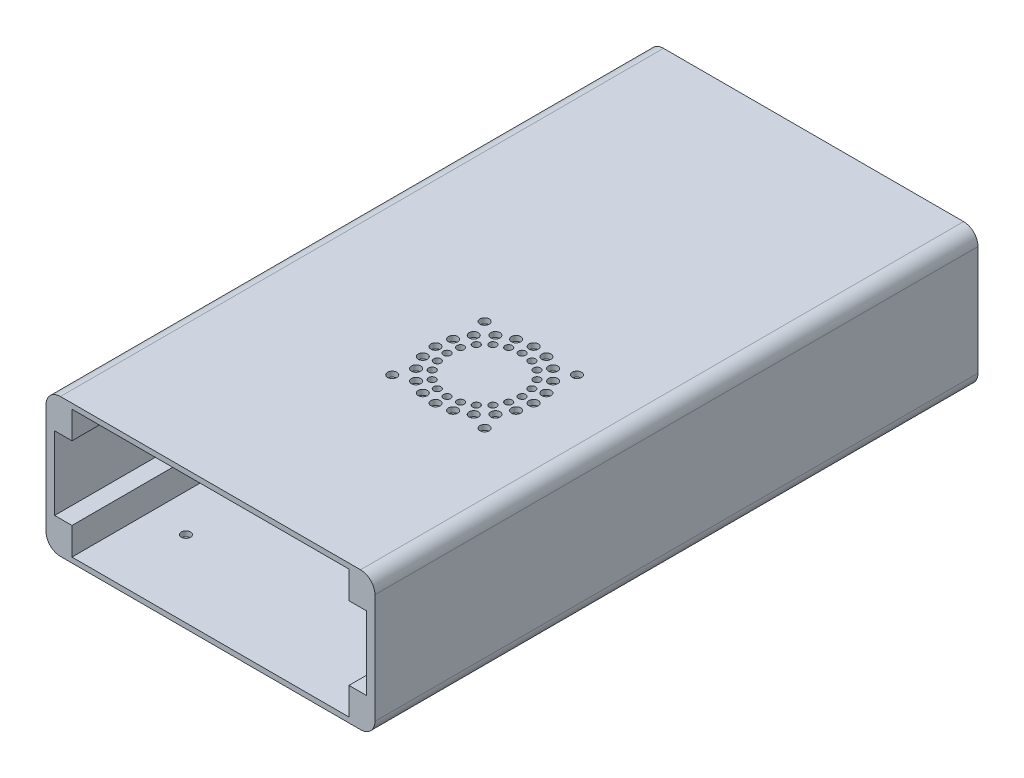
SolidWorks part; units mm, degrees
ref_plane "Front Plane" through (0, 0, 0) normal (0, 0, 1) x (1, 0, 0)
ref_plane "Top Plane" through (0, 0, 0) normal (0, 1, 0) x (1, 0, 0)
ref_plane "Right Plane" through (0, 0, 0) normal (1, 0, 0) x (0, 0, -1)
sketch "Sketch1" plane through (0, 0, 0) normal (0, 0, 1) x (1, 0, 0)
  line L0 (-110.5, 1) -> (-6.5, 1)
  line L1 (-1.5, 6) -> (-1.5, 44)
  line L2 (-6.5, 49) -> (-110.5, 49)
  line L3 (-115.5, 44) -> (-115.5, 6)
  line L8 (-10.5, 2.8) -> (-10.5, 12.3)
  line L9 (-106.5, 2.8) -> (-106.5, 12.3)
  line L10 (-106.5, 2.8) -> (-10.5, 2.8)
  line L11 (-10.5, 12.3) -> (-4.5, 12.3)
  line L12 (-106.5, 47.2) -> (-10.5, 47.2)
  line L13 (-10.5, 47.2) -> (-10.5, 37.7)
  line L14 (-106.5, 47.2) -> (-106.5, 37.7)
  line L15 (-106.5, 12.3) -> (-112.5, 12.3)
  line L16 (-112.5, 12.3) -> (-112.5, 37.7)
  line L17 (-112.5, 37.7) -> (-106.5, 37.7)
  line L18 (-4.5, 12.3) -> (-4.5, 37.7)
  line L19 (-4.5, 37.7) -> (-10.5, 37.7)
  arc A0 (-110.5, 1) -> (-115.5, 6) centre (-110.5, 6) cw
  arc A1 (-6.5, 1) -> (-1.5, 6) centre (-6.5, 6) ccw
  arc A2 (-1.5, 44) -> (-6.5, 49) centre (-6.5, 44) ccw
  arc A3 (-110.5, 49) -> (-115.5, 44) centre (-110.5, 44) ccw
  point P14 (-115.5, 1)
  point P17 (-1.5, 1)
  point P20 (-1.5, 49)
  dimension "D7" = 5
  dimension "D1" = 114
  dimension "D4" = 48
  dimension "D8" = 9
  dimension "D9" = 96
  dimension "D10" = 9
  dimension "D11" = 1.8
  dimension "D12" = 3
  dimension "D13" = 1.8
  dimension "D14" = 3
extrude "Boss-Extrude1" add sketch "Sketch1" against normal blind 209
sketch "Sketch2" plane through (0, 49, 0) normal (0, 1, 0) x (1, 0, 0)
  line L0 (-6.5, 0) -> (-110.5, 0) construction
  line L1 (-63.5, 100) -> (-23.5, 100) construction
  line L2 (-63.5, 100) -> (-63.5, 60) construction
  line L3 (-63.5, 60) -> (-23.5, 60) construction
  line L4 (-23.5, 100) -> (-23.5, 60) construction
  line L5 (-63.5, 100) -> (-23.5, 60) construction
  line L6 (-63.5, 60) -> (-23.5, 100) construction
  line L7 (-59.5, 96) -> (-27.5, 96) construction
  line L8 (-59.5, 96) -> (-59.5, 64) construction
  line L9 (-59.5, 64) -> (-27.5, 64) construction
  line L10 (-27.5, 96) -> (-27.5, 64) construction
  line L11 (-59.5, 96) -> (-27.5, 64) construction
  line L12 (-59.5, 64) -> (-27.5, 96) construction
  line L13 (-1.5, 209) -> (-1.5, 0) construction
  line L14 (-43.5, 80) -> (-75.4483, 80) construction
  circle A0 centre (-59.5, 96) radius 1.6
  circle A1 centre (-27.5, 96) radius 1.6
  circle A2 centre (-27.5, 64) radius 1.6
  circle A3 centre (-59.5, 64) radius 1.6
  circle A4 centre (-43.5, 80) radius 11 construction
  circle A5 centre (-43.5, 80) radius 19 construction
  circle A6 centre (-60.5, 80) radius 1.6
  circle A7 centre (-56.5, 80) radius 1.25
  circle A8 centre (-59.668, 85.2533) radius 1.6
  circle A9 centre (-55.8637, 84.0172) radius 1.25
  circle A10 centre (-57.2533, 89.9923) radius 1.6
  circle A11 centre (-54.0172, 87.6412) radius 1.25
  circle A12 centre (-53.4923, 93.7533) radius 1.6
  circle A13 centre (-51.1412, 90.5172) radius 1.25
  circle A14 centre (-48.7533, 96.168) radius 1.6
  circle A15 centre (-47.5172, 92.3637) radius 1.25
  circle A16 centre (-43.5, 97) radius 1.6
  circle A17 centre (-43.5, 93) radius 1.25
  circle A18 centre (-38.2467, 96.168) radius 1.6
  circle A19 centre (-39.4828, 92.3637) radius 1.25
  circle A20 centre (-33.5077, 93.7533) radius 1.6
  circle A21 centre (-35.8588, 90.5172) radius 1.25
  circle A22 centre (-29.7467, 89.9923) radius 1.6
  circle A23 centre (-32.9828, 87.6412) radius 1.25
  circle A24 centre (-27.332, 85.2533) radius 1.6
  circle A25 centre (-31.1363, 84.0172) radius 1.25
  circle A26 centre (-26.5, 80) radius 1.6
  circle A27 centre (-30.5, 80) radius 1.25
  circle A28 centre (-27.332, 74.7467) radius 1.6
  circle A29 centre (-31.1363, 75.9828) radius 1.25
  circle A30 centre (-29.7467, 70.0077) radius 1.6
  circle A31 centre (-32.9828, 72.3588) radius 1.25
  circle A32 centre (-33.5077, 66.2467) radius 1.6
  circle A33 centre (-35.8588, 69.4828) radius 1.25
  circle A34 centre (-38.2467, 63.832) radius 1.6
  circle A35 centre (-39.4828, 67.6363) radius 1.25
  circle A36 centre (-43.5, 63) radius 1.6
  circle A37 centre (-43.5, 67) radius 1.25
  circle A38 centre (-48.7533, 63.832) radius 1.6
  circle A39 centre (-47.5172, 67.6363) radius 1.25
  circle A40 centre (-53.4923, 66.2467) radius 1.6
  circle A41 centre (-51.1412, 69.4828) radius 1.25
  circle A42 centre (-57.2533, 70.0077) radius 1.6
  circle A43 centre (-54.0172, 72.3588) radius 1.25
  circle A44 centre (-59.668, 74.7467) radius 1.6
  circle A45 centre (-55.8637, 75.9828) radius 1.25
  point P0 (-43.5, 80)
  point P1 (-43.5, 80)
  point P6 (-43.5, 80)
  point P32 (-43.5, 80)
  point P37 (-43.5, 80)
  point P42 (-43.5, 80)
  point P47 (-43.5, 80)
  point P52 (-43.5, 80)
  point P57 (-43.5, 80)
  point P62 (-43.5, 80)
  point P67 (-43.5, 80)
  point P72 (-43.5, 80)
  point P77 (-43.5, 80)
  point P82 (-43.5, 80)
  point P87 (-43.5, 80)
  point P92 (-43.5, 80)
  point P97 (-43.5, 80)
  point P102 (-43.5, 80)
  point P107 (-43.5, 80)
  point P112 (-43.5, 80)
  point P117 (-43.5, 80)
  point P122 (-43.5, 80)
  dimension "D7" = 4
  dimension "D1" = 40
  dimension "D2" = 40
  dimension "D3" = 32
  dimension "D4" = 32
  dimension "D5" = 60
  dimension "D6" = 22
  dimension "D8" = 13
  dimension "D9" = 20
extrude "Cut-Extrude1" cut sketch "Sketch2" against normal up to next (1.8 mm away)
sketch "Sketch4" plane through (0, 1, 0) normal (0, -1, 0) x (1, 0, 0)
  line L0 (-1.5, -209) -> (-1.5, 0) construction
  line L1 (-6.5, 0) -> (-110.5, 0) construction
  line L2 (-6.5, -209) -> (-110.5, -209) construction
  circle A0 centre (-16.5, -26.5) radius 1.6
  circle A1 centre (-16.5, -103.5) radius 1.6
  circle A2 centre (-93.5, -26.5) radius 1.6
  circle A3 centre (-93.5, -103.5) radius 1.6
  circle A4 centre (-65.5, -154) radius 2.25
  dimension "D1" = 3.2
  dimension "D4" = 3.2
  dimension "D7" = 3.2
  dimension "D8" = 3.2
  dimension "D11" = 4.5
  dimension "D2" = 15
  dimension "D3" = 26.5
  dimension "D5" = 77
  dimension "D6" = 77
  dimension "D9" = 77
  dimension "D10" = 77
  dimension "D12" = 55
  dimension "D13" = 64
extrude "Cut-Extrude2" cut sketch "Sketch4" against normal blind 10
